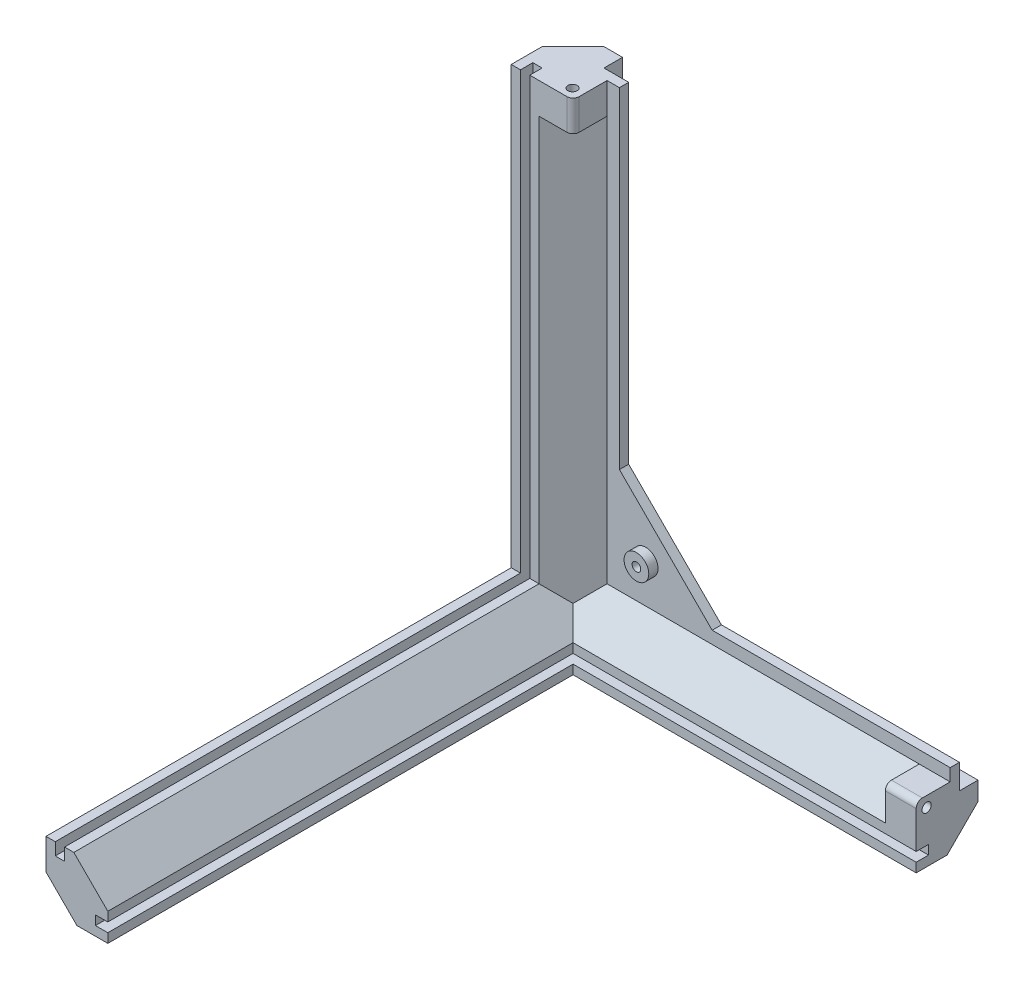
SolidWorks part; units mm, degrees
ref_plane "Front Plane" through (0, 0, 0) normal (0, 0, 1) x (1, 0, 0)
ref_plane "Top Plane" through (0, 0, 0) normal (0, 1, 0) x (1, 0, 0)
ref_plane "Right Plane" through (0, 0, 0) normal (1, 0, 0) x (0, 0, -1)
sketch "Sketch1" plane through (0, 0, 0) normal (0, 1, 0) x (1, 0, 0)
  line L0 (-60.0579, 3.4523) -> (-50.0579, 3.4523) construction
  line L1 (-50.0579, 3.4523) -> (-50.0579, 13.4523) construction
  line L2 (-60.0579, 3.4523) -> (-50.0579, 13.4523)
  line L3 (-50.0579, 13.4523) -> (-40.0579, 13.4523)
  line L4 (-40.0579, 13.4523) -> (-40.0579, 10.4523)
  line L5 (-40.0579, 10.4523) -> (-44.0579, 10.4523)
  line L6 (-44.0579, 10.4523) -> (-44.0579, 7.4523)
  line L7 (-44.0579, 7.4523) -> (-40.0579, 7.4523)
  line L8 (-40.0579, 7.4523) -> (-40.0579, 4.4523)
  line L9 (-60.0579, 3.4523) -> (-60.0579, -6.5477)
  line L10 (-60.0579, -6.5477) -> (-57.0579, -6.5477)
  line L11 (-57.0579, -6.5477) -> (-57.0579, -2.5477)
  line L12 (-57.0579, -2.5477) -> (-54.0579, -2.5477)
  line L13 (-54.0579, -2.5477) -> (-54.0579, -6.5477)
  line L14 (-54.0579, -6.5477) -> (-51.0579, -6.5477)
  line L15 (-40.0579, 4.4523) -> (-51.0579, -6.5477)
extrude "Boss-Extrude1" add sketch "Sketch1" along normal blind 141
sketch "Sketch2" plane through (0, 0, 6.5477) normal (0, 0, 1) x (1, 0, 0)
  line L0 (-54.0579, 0) -> (-54.0579, -3.2274) construction
  line L1 (-57.0579, 0) -> (-57.0579, -4)
  line L2 (-57.0579, -4) -> (-54.0579, -4)
  line L3 (-54.0579, -4) -> (-54.0579, 0)
  line L4 (-54.0579, 0) -> (-51.0579, 0)
  line L5 (-57.0579, 0) -> (-60.0579, 0)
  line L6 (-60.0579, 0) -> (-60.0579, -10)
  line L7 (-60.0579, -10) -> (-50.0579, -10) construction
  line L8 (-50.0579, -10) -> (-50.0579, -20) construction
  line L9 (-50.0579, -20) -> (-60.0579, -10)
  line L10 (-50.0579, -20) -> (-40.0579, -20)
  line L11 (-40.0579, -20) -> (-40.0579, -17)
  line L12 (-40.0579, -17) -> (-44.0579, -17)
  line L13 (-44.0579, -17) -> (-44.0579, -14)
  line L14 (-44.0579, -14) -> (-40.0579, -14)
  line L15 (-40.0579, -14) -> (-40.0579, -11)
  line L16 (-40.0579, -11) -> (-51.0579, 0)
extrude "Boss-Extrude2" add sketch "Sketch2" along normal blind 150.5 separate body
sketch "Sketch3" plane through (-40.0579, 0, 0) normal (1, 0, 0) x (0, 0, -1)
  line L0 (-6.5477, -11) -> (-6.5477, -14)
  line L1 (-6.5477, -14) -> (-2.5477, -14)
  line L2 (-2.5477, -14) -> (-2.5477, -17)
  line L3 (-2.5477, -17) -> (-6.5477, -17)
  line L4 (-6.5477, -17) -> (-6.5477, -20)
  line L5 (-6.5477, -20) -> (3.4523, -20)
  line L6 (7.4523, 0) -> (7.4523, -4)
  line L7 (7.4523, -4) -> (10.4523, -4)
  line L8 (10.4523, -4) -> (10.4523, 0)
  line L9 (10.4523, 0) -> (13.4523, 0)
  line L10 (13.4523, 0) -> (13.4523, -10)
  line L11 (13.4523, -10) -> (3.4523, -20)
  line L12 (-6.5477, -11) -> (4.4523, 0)
  line L13 (4.4523, 0) -> (7.4523, 0)
extrude "Boss-Extrude3" add sketch "Sketch3" along normal blind 111 separate body
sketch "Sketch4" plane through (0, 0, -13.4523) normal (0, 0, -1) x (-1, 0, 0)
  line L0 (40.0579, 0) -> (40.0579, -20)
  line L1 (40.0579, -20) -> (60.0579, -20)
  line L2 (60.0579, -20) -> (60.0579, 0)
  line L3 (60.0579, 0) -> (40.0579, 0)
extrude "Boss-Extrude4" add sketch "Sketch4" against normal blind 20
sketch "Sketch5" plane through (0, 0, 6.5477) normal (0, 0, 1) x (1, 0, 0)
  line L0 (-50.0579, -20) -> (-60.0579, -10)
  line L1 (-60.0579, -10) -> (-60.0579, -20)
  line L2 (-60.0579, -20) -> (-50.0579, -20)
extrude "Cut-Extrude1" cut sketch "Sketch5" against normal blind 20
sketch "Sketch6" plane through (0, 0, 0) normal (0, 1, 0) x (1, 0, 0)
  line L0 (-60.0579, 3.4523) -> (-50.0579, 13.4523)
  line L1 (-50.0579, 13.4523) -> (-60.0579, 13.4523)
  line L2 (-60.0579, 13.4523) -> (-60.0579, 3.4523)
extrude "Cut-Extrude2" cut sketch "Sketch6" against normal blind 20
sketch "Sketch7" plane through (-40.0579, 0, 0) normal (1, 0, 0) x (0, 0, -1)
  line L0 (13.4523, -10) -> (3.4523, -20)
  line L1 (3.4523, -20) -> (13.4523, -20)
  line L2 (13.4523, -20) -> (13.4523, -10)
extrude "Cut-Extrude3" cut sketch "Sketch7" against normal blind 20
sketch "Sketch8" plane through (-40.0579, 0, 0) normal (1, 0, 0) x (0, 0, -1)
  line L0 (-6.5477, -14) -> (-2.5477, -14)
  line L1 (-2.5477, -14) -> (-2.5477, -17)
  line L2 (-2.5477, -17) -> (-6.5477, -17)
  line L3 (-6.5477, -17) -> (-6.5477, -14)
extrude "Cut-Extrude4" cut sketch "Sketch8" against normal blind 4
sketch "Sketch9" plane through (-40.0579, 0, 0) normal (1, 0, 0) x (0, 0, -1)
  line L0 (7.4523, 0) -> (10.4523, 0)
  line L1 (10.4523, 0) -> (10.4523, -4)
  line L2 (10.4523, -4) -> (7.4523, -4)
  line L3 (7.4523, -4) -> (7.4523, 0)
extrude "Cut-Extrude5" cut sketch "Sketch9" against normal blind 4
sketch "Sketch10" plane through (0, 0, 0) normal (0, 1, 0) x (1, 0, 0)
  line L0 (-57.0579, -2.5477) -> (-54.0579, -2.5477)
  line L1 (-54.0579, -2.5477) -> (-54.0579, -6.5477)
  line L2 (-54.0579, -6.5477) -> (-57.0579, -6.5477)
  line L3 (-57.0579, -6.5477) -> (-57.0579, -2.5477)
extrude "Cut-Extrude6" cut sketch "Sketch10" against normal blind 4
sketch "Sketch11" plane through (0, 0, 0) normal (0, 1, 0) x (1, 0, 0)
  line L0 (-51.0579, -6.5477) -> (-40.0579, 4.4523)
  line L1 (-40.0579, 4.4523) -> (-40.0579, -6.5477)
  line L2 (-40.0579, -6.5477) -> (-51.0579, -6.5477)
extrude "Cut-Extrude7" cut sketch "Sketch11" against normal blind 11
sketch "Sketch12" plane through (-40.0579, 0, 0) normal (-1, 0, 0) x (0, 0, 1)
  line L0 (6.5477, -11) -> (-4.4523, -11)
  line L1 (-4.4523, -11) -> (-4.4523, 0)
  line L2 (-4.4523, 0) -> (6.5477, -11)
extrude "Boss-Extrude5" add sketch "Sketch12" along normal blind 10
sketch "Sketch13" plane through (0, 0, 6.5477) normal (0, 0, -1) x (-1, 0, 0)
  line L0 (40.0579, -11) -> (51.0579, -11)
  line L1 (51.0579, -11) -> (51.0579, 0)
  line L2 (51.0579, 0) -> (40.0579, -11)
extrude "Boss-Extrude6" add sketch "Sketch13" along normal blind 10
sketch "Sketch15" plane through (0, 0, -10.4523) normal (0, 0, 1) x (1, 0, 0)
  line L0 (-44.0579, -4) -> (70.9421, -4)
  line L1 (70.9421, -4) -> (70.9421, 0)
  line L2 (70.9421, 0) -> (-40.0579, 0)
  line L3 (-40.0579, 0) -> (-40.0579, 141)
  line L4 (-40.0579, 141) -> (-44.0579, 141)
  line L5 (-44.0579, 141) -> (-44.0579, -4)
extrude "Cut-Extrude9" cut sketch "Sketch15" against normal through all
sketch "Sketch16" plane through (0, 0, 0) normal (0, 1, 0) x (1, 0, 0)
  line L0 (-40.0579, 7.4523) -> (-40.0579, 4.4523)
  line L1 (-40.0579, 4.4523) -> (70.9421, 4.4523)
  line L2 (70.9421, 4.4523) -> (70.9421, 7.4523)
  line L3 (70.9421, 7.4523) -> (-40.0579, 7.4523)
extrude "Boss-Extrude7" add sketch "Sketch16" along normal blind 4
sketch "Sketch17" plane through (-40.0579, 0, 0) normal (1, 0, 0) x (0, 0, -1)
  line L0 (7.4523, 4) -> (4.4523, 4)
  line L1 (4.4523, 4) -> (4.4523, 141)
  line L2 (4.4523, 141) -> (7.4523, 141)
  line L3 (7.4523, 141) -> (7.4523, 4)
extrude "Boss-Extrude8" add sketch "Sketch17" along normal blind 4
chamfer "Chamfer1" distance 30 angle 45 1 edges at (-36.0579, 4, -5.9523)
chamfer "Chamfer2" distance 20 angle 45 1 edges at (-44.0579, -4, -10.4523)
sketch "Sketch18" plane through (0, 0, -7.4523) normal (0, 0, -1) x (-1, 0, 0)
  line L0 (34.0579, 6) -> (21.0579, 19) construction
  line L1 (24.0579, -4) -> (44.0579, 16) construction
  line L2 (36.0579, 34) -> (6.0579, 4) construction
  circle A0 centre (27.5579, 12.5) radius 1.4
extrude "Cut-Extrude10" cut sketch "Sketch18" against normal through all
sketch "Sketch19" plane through (70.9421, 0, 0) normal (1, 0, 0) x (0, 0, -1)
  line L0 (4.4523, 0) -> (-8.9308, 0) construction
  line L1 (-6.5477, -11) -> (-6.5477, 0) construction
  line L2 (4.4523, 0) -> (-6.5477, 0)
  line L3 (-6.5477, 0) -> (-6.5477, -11)
  line L4 (-6.5477, -11) -> (4.4523, 0)
  line L5 (-1.0477, -5.5) -> (-3.1691, -3.3787) construction
  circle A0 centre (-3.1691, -3.3787) radius 1.5
extrude "Boss-Extrude9" add sketch "Sketch19" against normal blind 10
sketch "Sketch20" plane through (0, 141, 0) normal (0, 1, 0) x (1, 0, 0)
  line L0 (-51.0579, -6.5477) -> (-39.3593, -6.5477) construction
  line L1 (-40.0579, 4.4523) -> (-40.0579, -6.5477) construction
  line L2 (-40.0579, 4.4523) -> (-40.0579, -6.5477)
  line L3 (-40.0579, -6.5477) -> (-51.0579, -6.5477)
  line L4 (-51.0579, -6.5477) -> (-40.0579, 4.4523)
  line L5 (-45.6373, -1.1272) -> (-43.516, -3.2485) construction
  circle A0 centre (-43.516, -3.2485) radius 1.5
extrude "Boss-Extrude10" add sketch "Sketch20" against normal blind 10
fillet "Fillet1" radius 2 2 edges at (65.9421, 0, 6.5477) (-40.0579, 136, 6.5477)
sketch "Esquisse1" plane through (0, 0, -4.4523) normal (0, 0, 1) x (1, 0, 0)
  circle A0 centre (-27.5579, 12.5) radius 4
  circle A1 centre (-27.5579, 12.5) radius 1.4
extrude "Boss.-Extru.1" add sketch "Esquisse1" along normal blind 3
